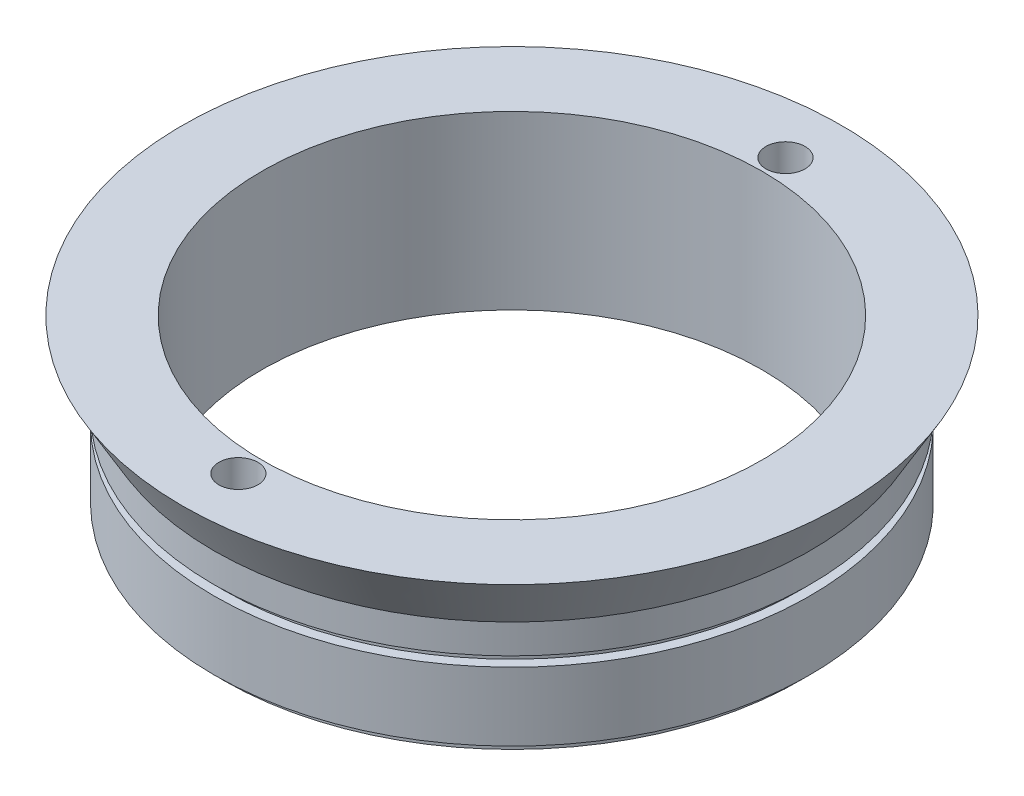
SolidWorks part; units mm, degrees
ref_plane "Front Plane" through (0, 0, 0) normal (0, 0, 1) x (1, 0, 0)
ref_plane "Top Plane" through (0, 0, 0) normal (0, 1, 0) x (1, 0, 0)
ref_plane "Right Plane" through (0, 0, 0) normal (1, 0, 0) x (0, 0, -1)
sketch "Sketch1" plane through (0, 0, 0) normal (1, 0, 0) x (0, 0, -1)
  line L0 (0, 0) -> (15.25, 0)
  line L1 (15.25, 0) -> (15.25, 6)
  line L2 (15.25, 6) -> (16.8666, 8.8)
  line L3 (16.8666, 8.8) -> (0, 8.8)
  line L4 (0, 8.8) -> (0, 0)
  dimension "D1" = 60
  dimension "D2" = 15.25
  dimension "D3" = 6
  dimension "D4" = 2.8
revolve "Revolve1" add sketch "Sketch1" angle 360 about L4
sketch "Sketch3" plane through (0, 0, 0) normal (0, -1, 0) x (1, 0, 0)
  circle A0 centre (0, 0) radius 12.8016
  dimension "D1" = 25.6032
extrude "Cut-Extrude1" cut sketch "Sketch3" against normal through all
sketch "Sketch4" plane through (0, 0, 0) normal (1, 0, 0) x (0, 0, -1)
  line L0 (-15.25, 6) -> (-15.25, 0) construction
  line L1 (-15.25, 4.5) -> (-14.75, 4.5)
  line L2 (-15.25, 4.5) -> (-15.25, 4)
  line L3 (-15.25, 4) -> (-14.75, 4)
  line L4 (-14.75, 4.5) -> (-14.75, 4)
  line L5 (-14.75, 4) -> (-14.75, 0.5) construction
  line L6 (-15.25, 0) -> (-14.75, 0)
  line L7 (-15.25, 0) -> (-15.25, 0.5)
  line L8 (-15.25, 0.5) -> (-14.75, 0.5)
  line L9 (-14.75, 0) -> (-14.75, 0.5)
  dimension "D1" = 0.5
  dimension "D2" = 0.5
  dimension "D3" = 0.5
  dimension "D4" = 4
revolve "Cut-Revolve2" cut sketch "Sketch4" angle 360 about axis through (0, 6, 0) along (0, 1, 0)
hole_wizard "Ø2.0 (2) Diameter Hole1" positions "Sketch6" profile "Sketch5" hole size "Ø2.0" standard "ANSI Metric"
sketch "Sketch6" plane through (0, 8.8, 0) normal (0, 1, 0) x (1, 0, 0)
  line L0 (0, 14) -> (0, 0) construction
  line L1 (0, 0) -> (0, -14) construction
  point P0 (0, 14)
  point P2 (0, -14)
  dimension "D1" = 14
sketch "Sketch5" plane through (0, 8.8, -14) normal (1, 0, 0) x (0, 0, 1)
  line L0 (0, 0) -> (0, 3.6009)
  line L1 (0, 3.6009) -> (1, 3)
  line L2 (1, 3) -> (1, 0)
  line L5 (1, 0) -> (0, 0)
  line L10 (0, 3.6009) -> (-1, 3) construction
  line L11 (0, -6.35) -> (0, 107.95) construction
  dimension "Hole Dia." = 2
  dimension "Hole Depth" = 3
  dimension "Drill Angle" = 118
